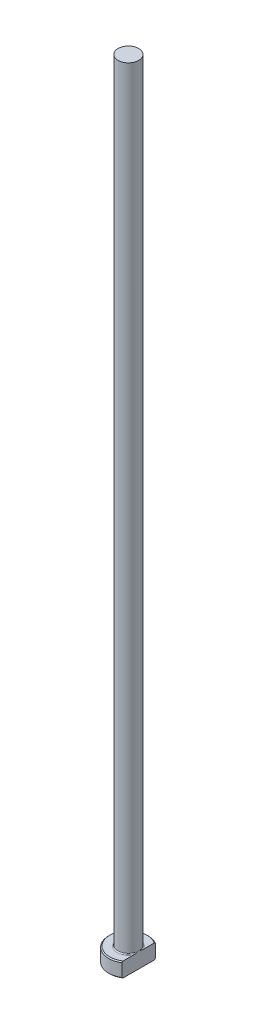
SolidWorks part; units mm, degrees
ref_plane "Front Plane" through (0, 0, 0) normal (0, 0, 1) x (1, 0, 0)
ref_plane "Top Plane" through (0, 0, 0) normal (0, 1, 0) x (1, 0, 0)
ref_plane "Right Plane" through (0, 0, 0) normal (1, 0, 0) x (0, 0, -1)
sketch "Sketch1" plane through (0, 0, 0) normal (0, 0, 1) x (1, 0, 0)
  line L0 (0, 259.9588) -> (0, -15.1925) construction
  line L1 (0, 0) -> (-4, 0)
  line L2 (-4, 0) -> (-4, 3)
  line L3 (-4, 3) -> (-2.1, 3)
  line L4 (-2.1, 3) -> (-2.1, 160)
  line L5 (-2.1, 160) -> (0, 160)
  line L6 (0, 160) -> (0, 0)
  dimension "L" = 160
  dimension "H" = 8
  dimension "T" = 3
  dimension "D" = 4.2
revolve "Revolve1" add sketch "Sketch1" angle 360 about L0
chamfer "Chamfer1" distance 0.2 angle 45 2 edges at (0, 3, 4) (0, 0, 4)
fillet "Fillet1" radius 0.2 1 edges at (0, 3, 2.1)
sketch "Sketch2" plane through (0, 0, 0) normal (0, 1, 0) x (1, 0, 0)
  line L0 (2.1, 3.4044) -> (2.1, -3.4044)
  circle A0 centre (0, 0) radius 4 construction
  arc A1 (2.1, -3.4044) -> (2.1, 3.4044) centre (0, 0) ccw
  circle A2 centre (0, 0) radius 2.1 construction
extrude "KEY" cut sketch "Sketch2" along normal through all
